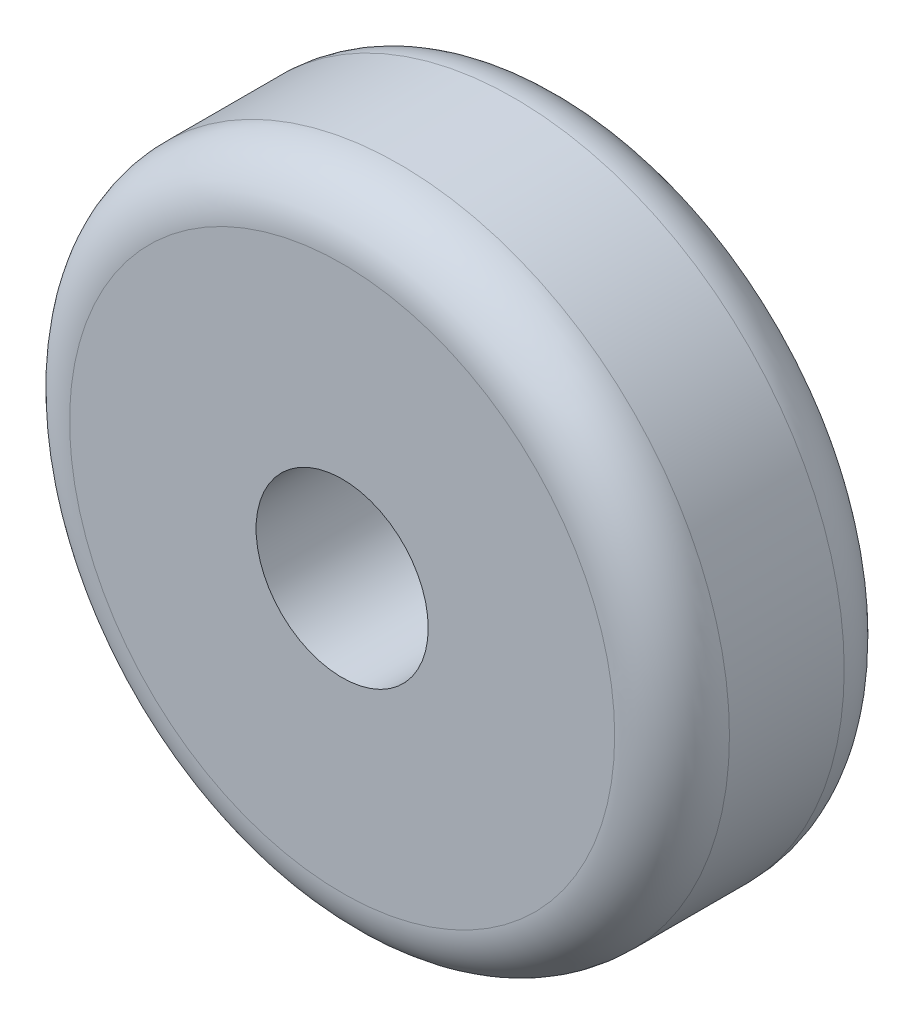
SolidWorks part; units mm, degrees
ref_plane "Piano frontale" through (0, 0, 0) normal (0, 0, 1) x (1, 0, 0)
ref_plane "Piano superiore" through (0, 0, 0) normal (0, 1, 0) x (1, 0, 0)
ref_plane "Piano destro" through (0, 0, 0) normal (1, 0, 0) x (0, 0, -1)
sketch "Schizzo1" plane through (0, 0, 0) normal (0, 0, 1) x (1, 0, 0)
  circle A0 centre (0, 0) radius 1.5
  circle A1 centre (0, 0) radius 5.75
  dimension "D1" = 3
  dimension "D2" = 11.5
extrude "Estrusione-Estrusione1" add sketch "Schizzo1" along normal blind 4
fillet "Raccordo1" radius 1 2 edges at (5.75, 0, 4) (5.75, 0, 0)
